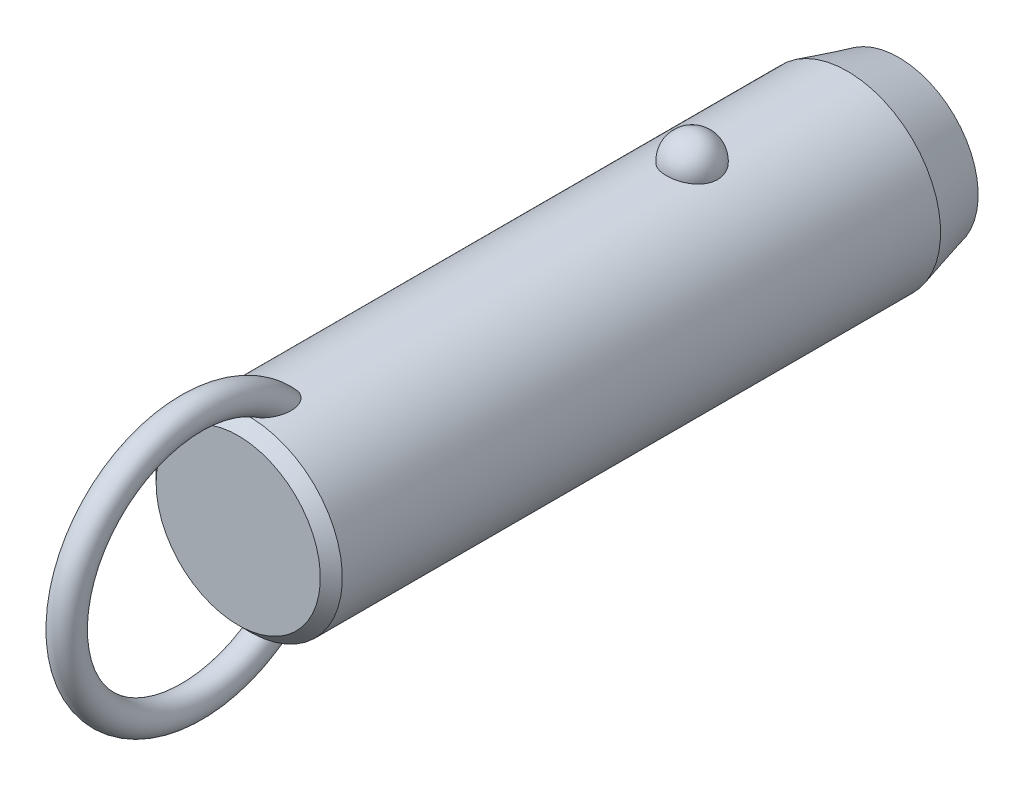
SolidWorks part; units mm, degrees
ref_plane "Front Plane" through (0, 0, 0) normal (0, 0, 1) x (1, 0, 0)
ref_plane "Top Plane" through (0, 0, 0) normal (0, 1, 0) x (1, 0, 0)
ref_plane "Right Plane" through (0, 0, 0) normal (1, 0, 0) x (0, 0, -1)
sketch "Sketch2" plane through (0, 0, 0) normal (0, 0, 1) x (1, 0, 0)
  circle A0 centre (0, 0) radius 12.7
  point P3 (0, 12.7)
  dimension "D1" = 25.4
extrude "Boss-Extrude1" add sketch "Sketch2" along normal blind 45.7
sketch "Sketch3" plane through (0, 0, 0) normal (0, 0, -1) x (-1, 0, 0)
  circle A0 centre (0, 0) radius 12.7
  dimension "D1" = 25.4
extrude "Boss-Extrude2" add sketch "Sketch3" along normal blind 31.7
chamfer "Chamfer1" distance 7 angle 15 1 edges at (-12.7, 0, -31.7)
sketch "Sketch12" plane through (0, 0, 0) normal (1, 0, 0) x (0, 0, -1)
  line L0 (-45.7, 12.7) -> (-45.7, -12.7) construction
  point P0 (-45.7, 0)
sketch "Sketch13" plane through (0, 0, 0) normal (1, 0, 0) x (0, 0, -1)
  circle A0 centre (-64.75, 0) radius 19.05
  point P2 (-45.7, 0)
  dimension "D1" = 38.1
sketch "Sketch14" plane through (0, 0, 0) normal (0, 1, 0) x (1, 0, 0)
  circle A0 centre (0, -47.7) radius 2
  point P2 (0, -45.7)
  dimension "D1" = 4
sweep "Sweep1" add profiles "Sketch14" path "Sketch13"
sketch "Sketch15" plane through (0, 0, 45.7) normal (0, 0, 1) x (1, 0, 0)
  circle A0 centre (0, 0) radius 12.7
  dimension "D1" = 25.4
extrude "Boss-Extrude3" add sketch "Sketch15" along normal blind 12.7
chamfer "Chamfer2" distance 1.5 angle 45 1 edges at (12.7, 0, 58.4)
sketch "Sketch18" plane through (0, 0, 0) normal (1, 0, 0) x (0, 0, -1)
  line L0 (24.7, 12.7) -> (-50.551, 12.7) construction
  line L1 (3.5, 16.2) -> (3.5, 9.2)
  line L2 (-50.551, -12.7) -> (24.7, -12.7) construction
  arc A0 (3.5, 16.2) -> (3.5, 9.2) centre (3.5, 12.7) ccw
  point P4 (0, 12.7)
  dimension "D1" = 28.9
revolve "Revolve1" add sketch "Sketch18" angle 360 about L1
